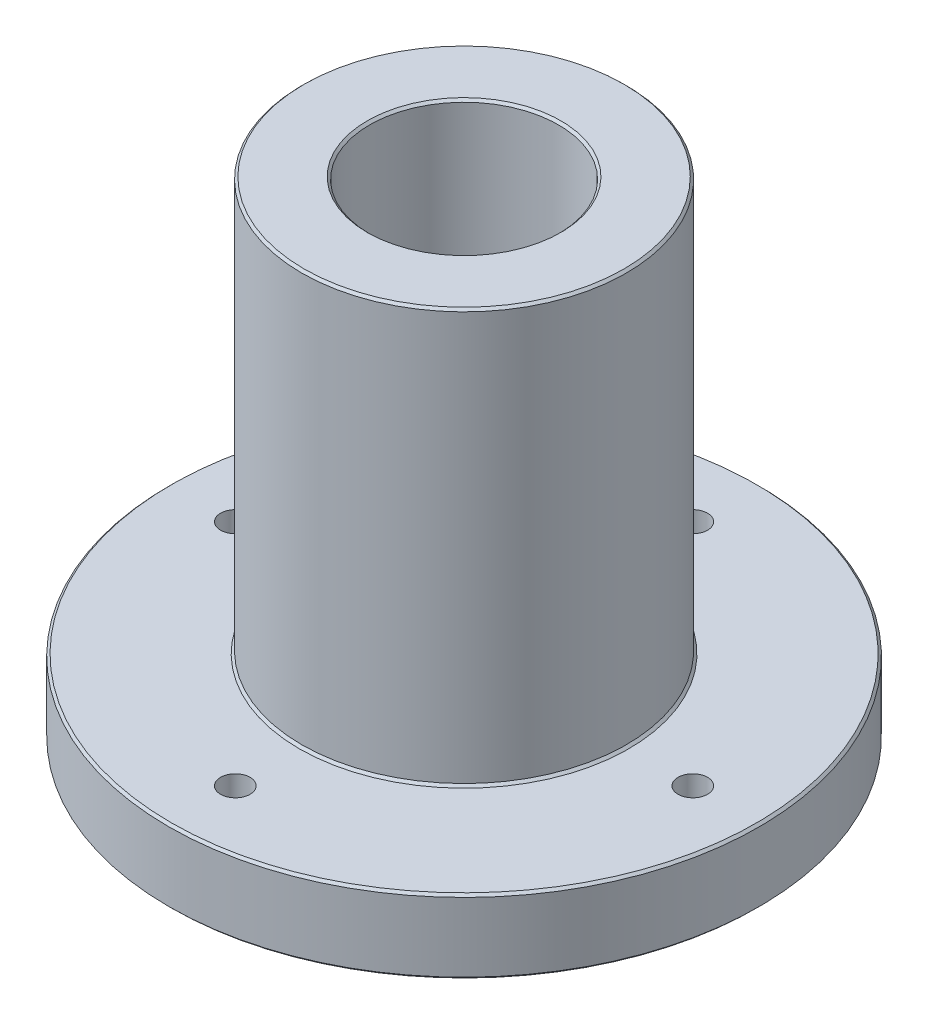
SolidWorks part; units mm, degrees
ref_plane "Front Plane" through (0, 0, 0) normal (0, 0, 1) x (1, 0, 0)
ref_plane "Top Plane" through (0, 0, 0) normal (0, 1, 0) x (1, 0, 0)
ref_plane "Right Plane" through (0, 0, 0) normal (1, 0, 0) x (0, 0, -1)
sketch "Sketch1" plane through (0, 0, 0) normal (0, 1, 0) x (1, 0, 0)
  circle A0 centre (0, 0) radius 10.16
  circle A1 centre (0, 0) radius 31.75
  point P17 (0, 0)
  point P18 (0, 0)
  point P19 (0, 0)
  dimension "D1" = 20.32
  dimension "D2" = 63.5
extrude "Boss-Extrude1" add sketch "Sketch1" along normal blind 7.9375
sketch "Sketch2" plane through (0, 7.9375, 0) normal (0, 1, 0) x (1, 0, 0)
  circle A0 centre (0, 0) radius 10.16
  circle A1 centre (0, 0) radius 17.4625
  dimension "D1" = 34.925
extrude "Boss-Extrude2" add sketch "Sketch2" along normal blind 44.45
sketch "Sketch3" plane through (0, 7.9375, 0) normal (0, 1, 0) x (1, 0, 0)
  line L0 (0, 17.4625) -> (0, 31.75) construction
  line L1 (-31.75, 0) -> (31.75, 0) construction
  line L2 (0, 17.4625) -> (0, -31.75) construction
  circle A0 centre (0, 0) radius 24.6062 construction
  circle A1 centre (0, 0) radius 17.4625 construction
  circle A2 centre (0, 0) radius 17.4625 construction
  circle A3 centre (0, 0) radius 31.75 construction
  circle A4 centre (-24.6062, 0) radius 1.5875
  circle A5 centre (0, 24.6062) radius 1.5875
  circle A6 centre (24.6063, 0) radius 1.5875
  circle A7 centre (0, -24.6063) radius 1.5875
  point P12 (0, 24.6062)
  point P25 (0, 0)
  point P26 (0, 0)
  dimension "D1" = 3.175
extrude "Cut-Extrude1" cut sketch "Sketch3" against normal through all
chamfer "Chamfer1" distance 0.254 angle 45 5 edges at (0, 7.9375, 17.4625) (0, 52.3875, 10.16) (0, 52.3875, 17.4625) (0, 0, 31.75) (0, 7.9375, 31.75)
